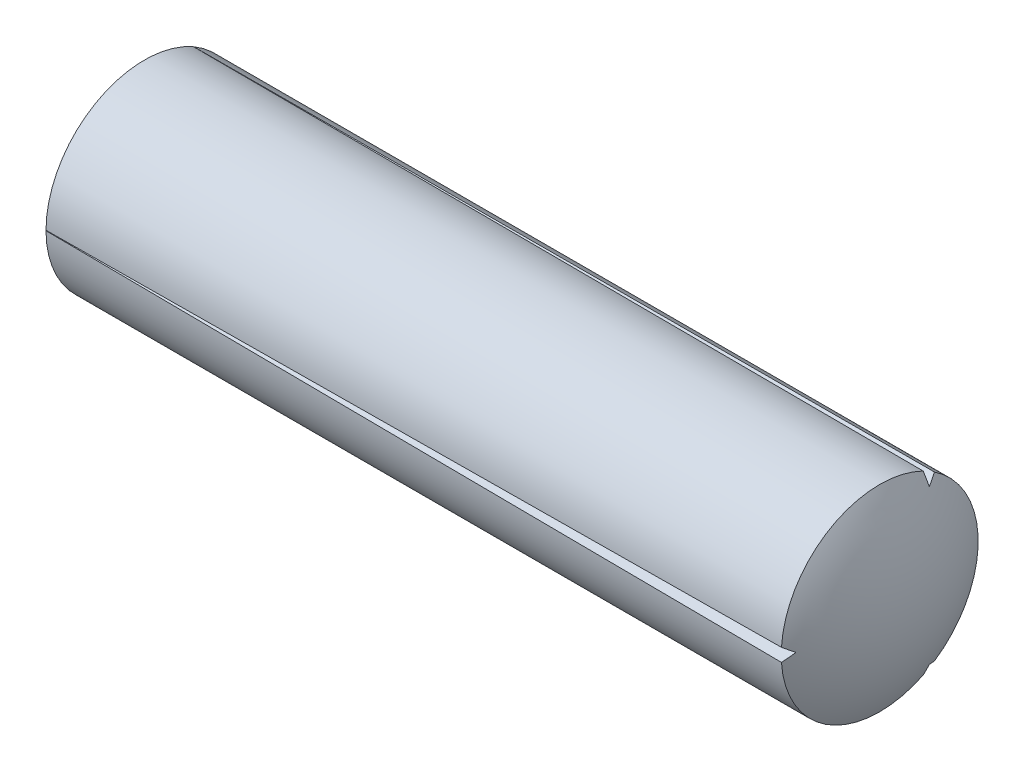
SolidWorks part; units mm, degrees
ref_plane "Plane1" through (0, 0, 0) normal (0, 0, 1) x (1, 0, 0)
ref_plane "Plane2" through (0, 0, 0) normal (0, 1, 0) x (1, 0, 0)
ref_plane "Plane3" through (0, 0, 0) normal (1, 0, 0) x (0, 0, -1)
sketch "Sketch1" plane through (0, 0, 0) normal (0, 0, 1) x (1, 0, 0)
  line L0 (-40, 0) -> (40, 0) construction
  line L1 (-100, 0) -> (-100, 1.25)
  line L2 (-96.6819, 12.5) -> (-3.3494, 12.5)
  line L4 (0, 0) -> (-100, 0)
  arc A0 (-96.6819, 12.5) -> (-100, 1.25) centre (-75.0313, 0) ccw
  arc A1 (0, 0) -> (-3.3494, 12.5) centre (-25, 0) ccw
  dimension "D2" = 25
  dimension "D1" = 25
  dimension "D3" = 2.5
  dimension "Diameter" = 25
  dimension "Length" = 100
revolve "Base-Revolve" add sketch "Sketch1" angle 360 about L0
sketch "Sketch2" plane through (0, 0, 0) normal (1, 0, 0) x (0, 0, -1)
  line L0 (0, 0) -> (-15, 0) construction
  line L1 (-11.25, 0) -> (-12.5, 0.8753)
  line L2 (-11.25, 0) -> (-12.5, -0.8753)
  line L3 (-12.5, -0.8753) -> (-12.5, 0.8753)
  circle A0 centre (0, 0) radius 11.25 construction
  circle A1 centre (0, 0) radius 12.5 construction
  dimension "D1" = 22.5
  dimension "D2" = 70
  dimension "D3" = 35
sketch "Sketch4" plane through (0, 0, 0) normal (0, 1, 0) x (1, 0, 0)
  line L0 (-110, 0) -> (10, 0) construction
  line L1 (-40, 0) -> (40, 0) construction
  line L2 (0, -11.25) -> (-100, -12.5)
  dimension "D1" = 22.5
  dimension "D2" = 100
  dimension "D3" = 25
sweep "Cut-Sweep1" cut profiles "Sketch2" path "Sketch4"
pattern_circular "CirPattern1" count 3 over 360 about axis through (0, 0, 0) along (1, 0, 0) of "Cut-Sweep1"
equation "\"D1@Sketch1\" = \"Diameter@Sketch1\""
equation "\"D2@Sketch1\" = \"Diameter@Sketch1\""
equation "\"D3@Sketch1\" = \"Diameter@Sketch1\" * .1"
equation "\"D1@Sketch2\" = \"Diameter@Sketch1\" * .9"
equation "\"D3@Sketch2\" = \"D2@Sketch2\" / 2"
equation "\"D1@Sketch4\" = \"D1@Sketch2\""
equation "\"D2@Sketch4\" = \"Length@Sketch1\""
equation "\"D3@Sketch4\" = \"Diameter@Sketch1\""
